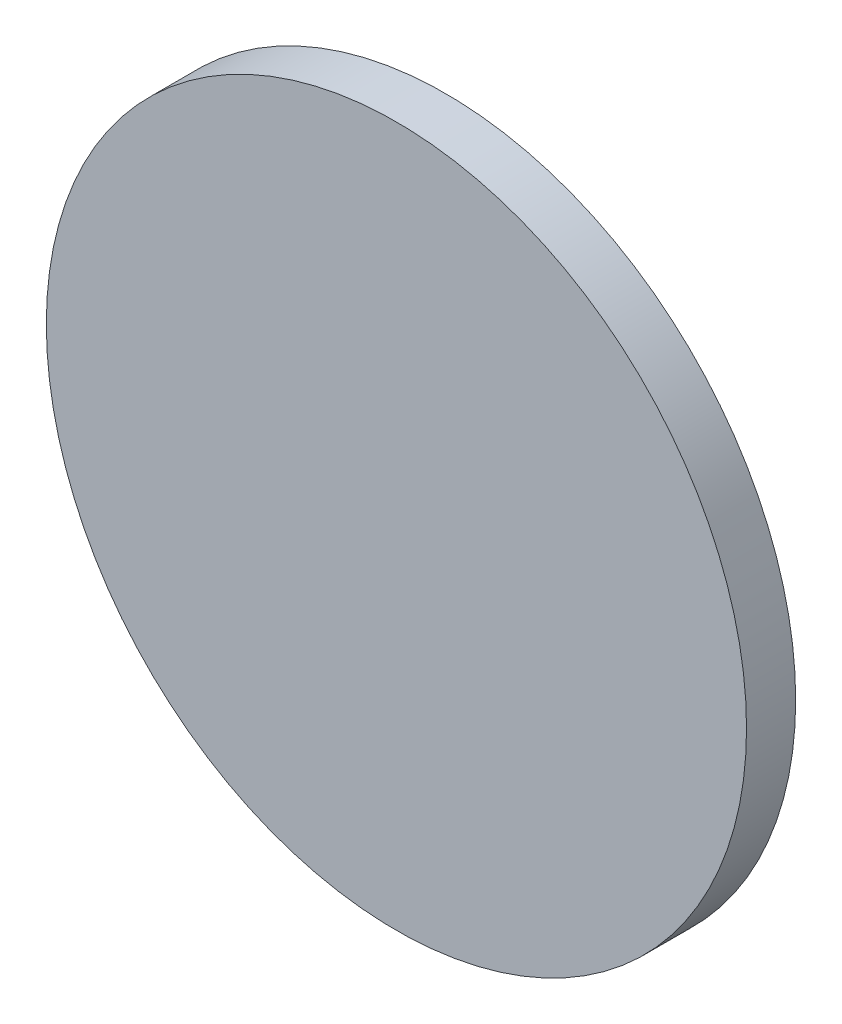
SolidWorks part; units mm, degrees
ref_plane "Front Plane" through (0, 0, 0) normal (0, 0, 1) x (1, 0, 0)
ref_plane "Top Plane" through (0, 0, 0) normal (0, 1, 0) x (1, 0, 0)
ref_plane "Right Plane" through (0, 0, 0) normal (1, 0, 0) x (0, 0, -1)
imported_body "Imported3"
sketch "Sketch1" plane through (0, 0, 2.7356) normal (0, 0, 1) x (1, 0, 0)
  circle A0 centre (0, 0) radius 37.5
extrude "Boss-Extrude1" add sketch "Sketch1" along normal blind 5.2644
sketch3d "3DSketch1" plane through (0, 0, 0) normal (0, 0, 1) x (1, 0, 0)
  dimension "D1" = 5
